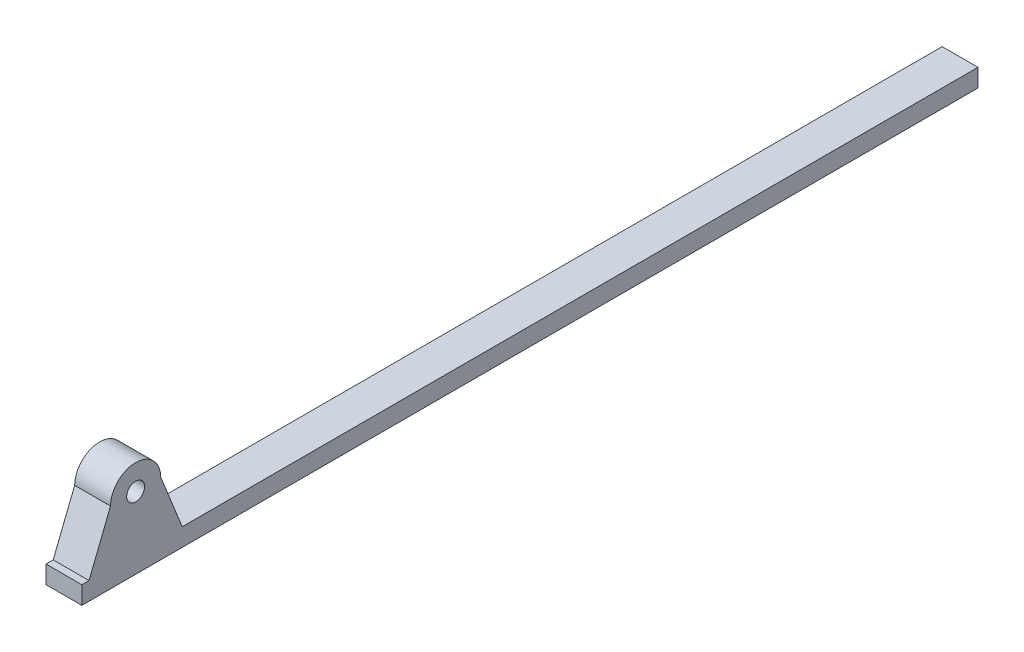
SolidWorks part; units mm, degrees
ref_plane "Alzado" through (0, 0, 0) normal (0, 0, 1) x (1, 0, 0)
ref_plane "Planta" through (0, 0, 0) normal (0, 1, 0) x (1, 0, 0)
ref_plane "Vista lateral" through (0, 0, 0) normal (1, 0, 0) x (0, 0, -1)
sketch "Croquis1" plane through (0, 0, 0) normal (1, 0, 0) x (0, 0, -1)
  line L0 (-110, 24.5) -> (-110, 15) construction
  line L1 (125, -2.5) -> (-125, -2.5)
  line L2 (125, -2.5) -> (125, 2.5)
  line L3 (125, 2.5) -> (-97, 2.5)
  line L4 (-125, -2.5) -> (-125, 2.5)
  line L5 (125, -2.5) -> (0, 0) construction
  line L6 (125, 2.5) -> (-125, -2.5) construction
  line L7 (-117, 17.5) -> (-123, 2.5)
  line L8 (-103, 17.5) -> (-97, 2.5)
  line L9 (-123, 2.5) -> (-125, 2.5)
  circle A0 centre (-110, 17.5) radius 2.5
  arc A1 (-103, 17.5) -> (-117, 17.5) centre (-110, 17.5) ccw
  point P0 (0, 0)
  dimension "D1" = 250
  dimension "D3" = 5
  dimension "D4" = 14
  dimension "D2" = 5
  dimension "D5" = 15
  dimension "D6" = 15
  dimension "D7" = 2
extrude "Saliente-Extruir1" add sketch "Croquis1" along normal mid plane 10
